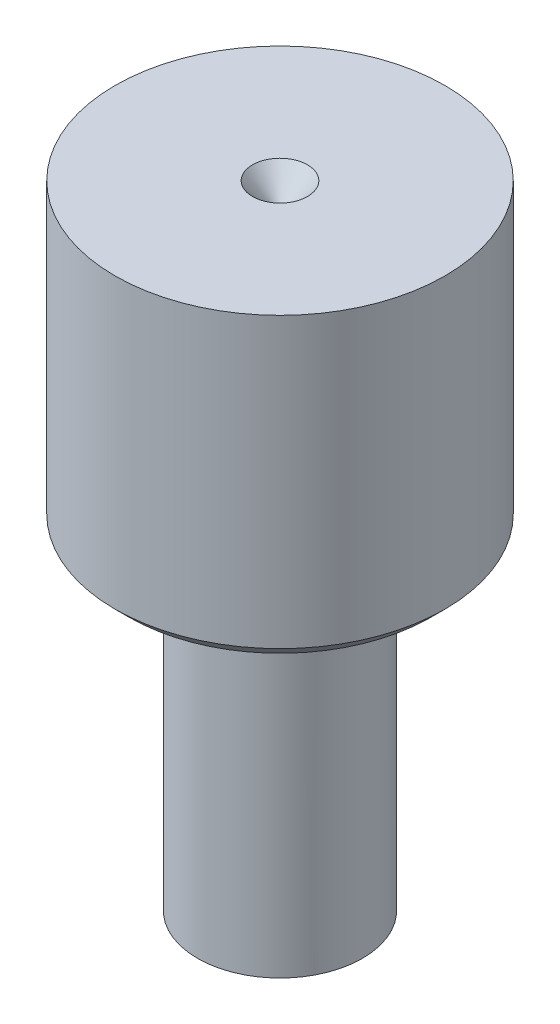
SolidWorks part; units mm, degrees
ref_plane "Plan de face" through (0, 0, 0) normal (0, 0, 1) x (1, 0, 0)
ref_plane "Plan de dessus" through (0, 0, 0) normal (0, 1, 0) x (1, 0, 0)
ref_plane "Plan de droite" through (0, 0, 0) normal (1, 0, 0) x (0, 0, -1)
sketch "Esquisse1" plane through (0, 0, 0) normal (0, 1, 0) x (1, 0, 0)
  circle A0 centre (0, 0) radius 6
  dimension "D1" = 12
extrude "Extrusion1" add sketch "Esquisse1" along normal blind 11
sketch "Esquisse2" plane through (0, 0, 0) normal (0, -1, 0) x (1, 0, 0)
  circle A0 centre (0, 0) radius 3
  dimension "D1" = 6
extrude "Extrusion2" add sketch "Esquisse2" along normal blind 12
sketch "Esquisse3" plane through (0, -12, 0) normal (0, -1, 0) x (1, 0, 0)
  circle A0 centre (0, 0) radius 1
  dimension "D1" = 2
extrude "Enlèv. mat.-Extru.1" cut sketch "Esquisse3" against normal through all draft 2
sketch "Esquisse4" plane through (0, 11, 0) normal (0, 1, 0) x (-1, 0, 0)
  circle A0 centre (0, 0) radius 1
  dimension "D1" = 2
extrude "Enlèv. mat.-Extru.2" cut sketch "Esquisse4" against normal blind 2 draft 40
chamfer "Chanfrein1" distance 0.5 angle 45 1 edges at (0, 0, 6)
fillet "Congé1" radius 0.4 1 edges at (0, 0, 3)
